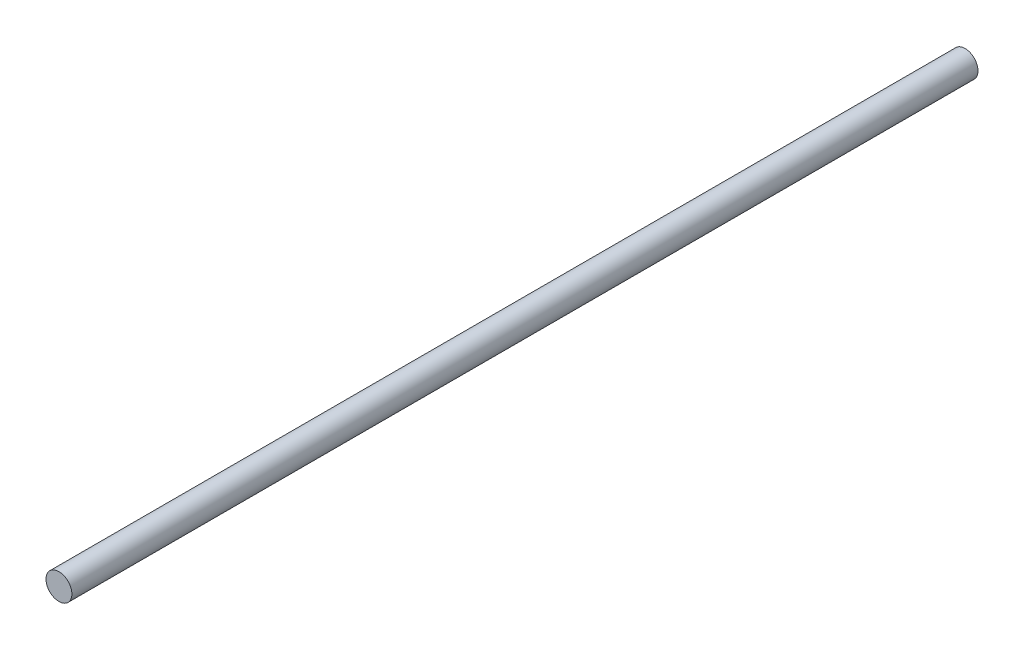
SolidWorks part; units mm, degrees
ref_plane "Front Plane" through (0, 0, 0) normal (0, 0, 1) x (1, 0, 0)
ref_plane "Top Plane" through (0, 0, 0) normal (0, 1, 0) x (1, 0, 0)
ref_plane "Right Plane" through (0, 0, 0) normal (1, 0, 0) x (0, 0, -1)
sketch "Sketch1" plane through (0, 0, 0) normal (0, 0, 1) x (1, 0, 0)
  circle A0 centre (0, 0) radius 30
  dimension "D1" = 60
extrude "Boss-Extrude1" add sketch "Sketch1" against normal blind 2100
